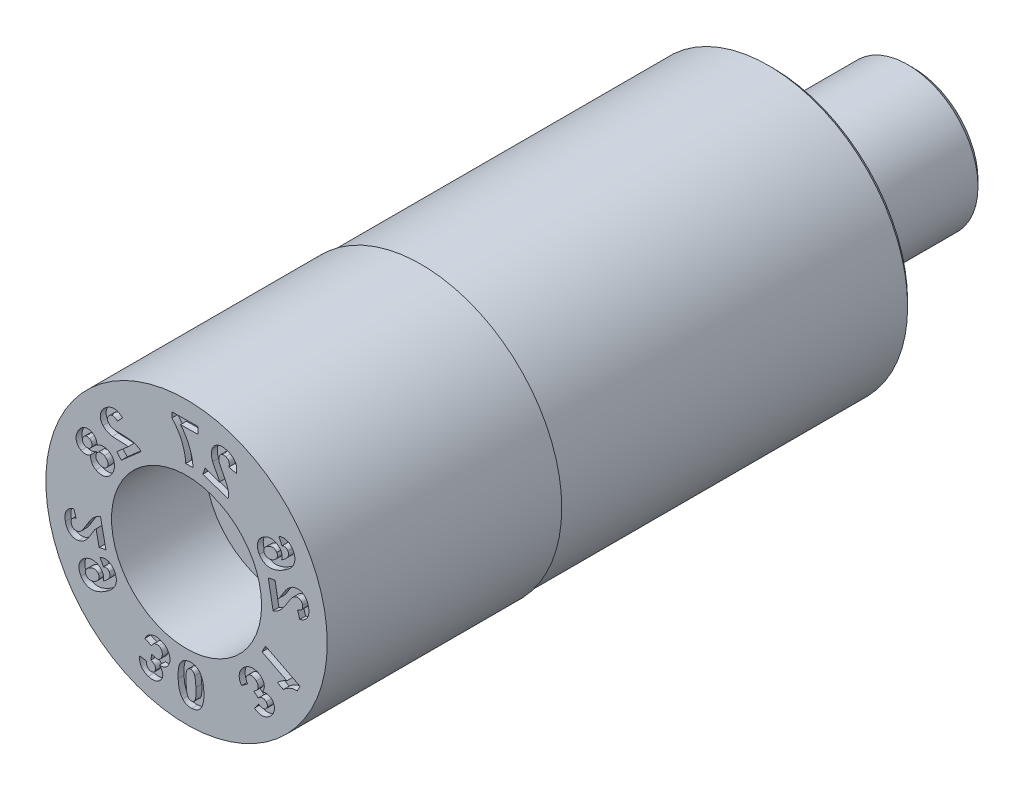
SolidWorks part; units mm, degrees
other "<M6 X 1 SHSS>-<Revolve1>"
ref_plane "Front Plane" through (0, 0, 0) normal (0, 0, 1) x (1, 0, 0)
ref_plane "Top Plane" through (0, 0, 0) normal (0, 1, 0) x (1, 0, 0)
ref_plane "Right Plane" through (0, 0, 0) normal (1, 0, 0) x (0, 0, -1)
sketch "Sketch1" plane through (0, 0, 0) normal (1, 0, 0) x (0, 0, -1)
  line L2 (0, 6) -> (0, 3.2)
  line L3 (24.75, 6) -> (0, 6)
  line L4 (-3.7979, 0) -> (49996.2021, 0) construction
  line L8 (19, 1.5) -> (4, 1.5)
  line L9 (4, 3.2) -> (4, 1.5)
  line L10 (4, 3.2) -> (0, 3.2)
  line L12 (25, 3) -> (25, 5.75)
  line L16 (25, 5.75) -> (24.75, 6)
  line L17 (25, 3) -> (19, 3)
  line L18 (19, 1.5) -> (19, 3)
  dimension "D1" = 25
  dimension "D2" = 45
  dimension "D3" = 0.25
  dimension "D4" = 12
  dimension "D5" = 6.4
  dimension "D6" = 4
  dimension "D7" = 3
  dimension "D8" = 6
  dimension "D9" = 6
revolve "Revolve1" add sketch "Sketch1" angle 360 about L4
sketch "Sketch4" plane through (0, 0, 0) normal (1, 0, 0) x (0, 0, -1)
  line L0 (0, 0) -> (50000, 0) construction
  line L1 (25, -5.75) -> (25, 5.75) construction
  line L2 (10, 6.935) -> (25, 6.935)
  line L3 (10, 6.935) -> (10, 5.935)
  line L4 (10, 5.935) -> (25, 5.935)
  line L5 (25, 6.935) -> (25, 5.935)
  line L6 (24.75, 6) -> (0, 6) construction
  line L9 (0, 6.6) -> (0, -6.6) construction
  dimension "D1" = 1
  dimension "D2" = 0.065
  dimension "D3" = 10
revolve "Cut-Revolve1" cut sketch "Sketch4" angle 360 about L0
sketch "Sketch2" plane through (0, 0, 0) normal (0, 0, 1) x (1, 0, 0)
  line L0 (0, 0) -> (0, 7.0261) construction
  line L1 (0, 0) -> (6.0848, 3.513) construction
  line L2 (0, 0) -> (6.0848, -3.513) construction
  line L3 (0, 0) -> (0, -7.0261) construction
  line L4 (0, 0) -> (-6.0848, -3.513) construction
  line L5 (0, 0) -> (-6.0848, 3.513) construction
  circle A0 centre (0.0094, -0.0094) radius 3.6901 construction
  text T0 "26  27  28  29  30  31" font "Arial" height 1.66
  point P11 (0, 0)
  point P161 (0, 0)
  point P162 (0.0094, 0)
  point P163 (0.0094, -0.0094)
  dimension "D1" = 6
extrude "Cut-Extrude1" cut sketch "Sketch2" against normal blind 0.25
sketch "Sketch3" plane through (0, 0, -4) normal (0, 0, 1) x (1, 0, 0)
  line L0 (0, 0) -> (0, 50000) construction
  line L1 (0.866, 1.5) -> (-0.866, 1.5)
  line L2 (-0.866, 1.5) -> (-1.7321, 0)
  line L3 (-1.7321, 0) -> (-0.866, -1.5)
  line L4 (-0.866, -1.5) -> (0.866, -1.5)
  line L5 (0.866, -1.5) -> (1.7321, 0)
  line L6 (1.7321, 0) -> (0.866, 1.5)
  line L7 (0, 0) -> (50000, 0) construction
  circle A0 centre (0, 0) radius 1.5 construction
  circle A1 centre (0, 0) radius 1.5 construction
extrude "Cut-Extrude2" cut sketch "Sketch3" against normal blind 3
inserted part "M6 X 1 SHSS"
move or copy body "Body-Move/Copy2" placed by mates yes
